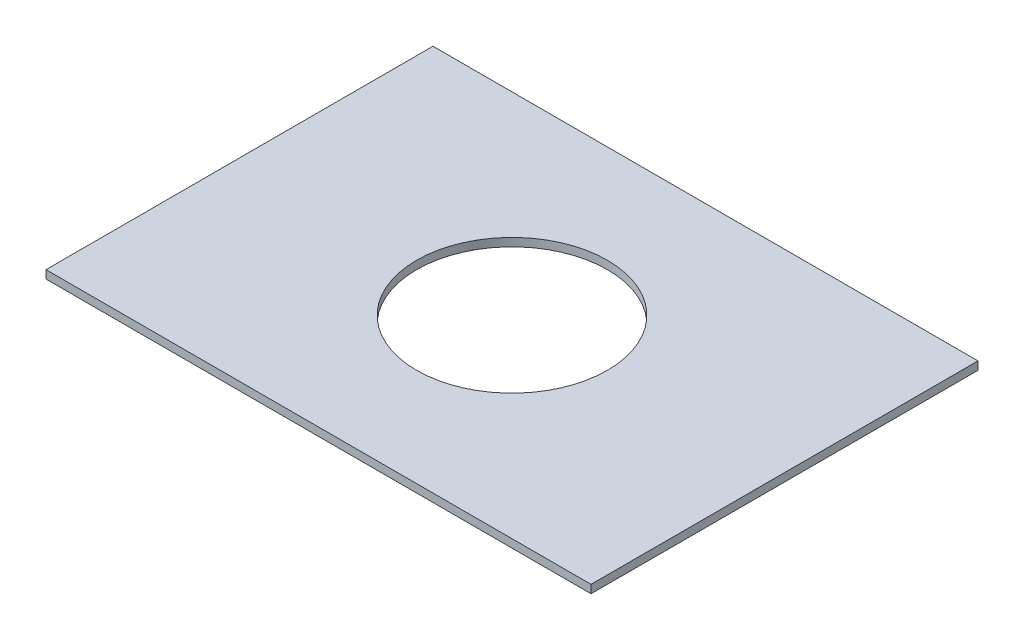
SolidWorks part; units mm, degrees
ref_plane "Plan de face" through (0, 0, 0) normal (0, 0, 1) x (1, 0, 0)
ref_plane "Plan de dessus" through (0, 0, 0) normal (0, 1, 0) x (1, 0, 0)
ref_plane "Plan de droite" through (0, 0, 0) normal (1, 0, 0) x (0, 0, -1)
sketch "Esquisse1" plane through (0, 0, 0) normal (0, 1, 0) x (1, 0, 0)
  line L1 (0, 0) -> (103, 0)
  line L2 (0, 0) -> (0, 75)
  line L3 (0, 75) -> (103, 75)
  line L4 (103, 0) -> (103, 75)
  dimension "D1" = 103
  dimension "D2" = 75
extrude "Boss.-Extru.1" add sketch "Esquisse1" along normal blind 1.5 contours L3 L4 L1 L2
sketch "Esquisse3" plane through (0, 1.5, 0) normal (0, 1, 0) x (1, 0, 0)
  line L0 (101.5, 1.5) -> (101.5, 73.5)
  line L1 (101.5, 73.5) -> (1.5, 73.5)
  line L2 (1.5, 73.5) -> (1.5, 1.5)
  line L3 (1.5, 1.5) -> (101.5, 1.5)
  line L4 (103, 0) -> (103, 75) construction
  line L5 (0, 0) -> (103, 0) construction
  line L6 (0, 0) -> (0, 75) construction
  line L7 (0, 75) -> (103, 75) construction
  line L8 (103, 0) -> (103, 75)
  line L9 (103, 75) -> (0, 75)
  line L10 (0, 75) -> (0, 0)
  line L11 (0, 0) -> (103, 0)
  dimension "D1" = 1.5
  dimension "D2" = 1.5
  dimension "D3" = 1.5
  dimension "D4" = 1.5
extrude "Enlèv. mat.-Extru.1" cut sketch "Esquisse3" against normal blind 10
sketch "Esquisse5" plane through (0, 1.5, 0) normal (0, 1, 0) x (1, 0, 0)
  line L0 (11.5, 1.5) -> (11.5, 10) construction
  line L1 (1.5, 1.5) -> (101.5, 1.5) construction
  line L2 (11.5, 10) -> (21.5, 10) construction
  line L3 (21.5, 10) -> (21.5, 1.5) construction
  line L4 (21.5, 1.5) -> (11.5, 1.5) construction
  line L5 (91.5, 1.5) -> (91.5, 10) construction
  line L6 (91.5, 10) -> (81.5, 10) construction
  line L7 (81.5, 10) -> (81.5, 1.5) construction
  line L8 (81.5, 1.5) -> (91.5, 1.5) construction
  point P6 (16.5, 1.5)
  point P7 (51.5, 1.5)
  point P12 (86.5, 1.5)
  dimension "D1" = 10
  dimension "D2" = 8.5
  dimension "D3" = 35
  dimension "D4" = 10
  dimension "D5" = 8.5
  dimension "D6" = 35
sketch "Esquisse6" plane through (0, 1.5, 0) normal (0, 1, 0) x (1, 0, 0)
  line L0 (101.5, 1.5) -> (101.5, 73.5) construction
  line L1 (101.5, 72.5) -> (1.5, 72.5)
  line L2 (101.5, 72.5) -> (101.5, 73.5)
  line L3 (101.5, 73.5) -> (1.5, 73.5)
  line L4 (1.5, 72.5) -> (1.5, 73.5)
  line L5 (1.5, 73.5) -> (1.5, 1.5) construction
  line L6 (101.5, 73.5) -> (1.5, 73.5) construction
  dimension "D1" = 1
extrude "Enlèv. mat.-Extru.3" cut sketch "Esquisse6" against normal blind 10
sketch "Esquisse7" plane through (0, 1.5, 0) normal (0, 1, 0) x (1, 0, 0)
  line L0 (51.5, 72.5) -> (51.5, 1.5) construction
  line L1 (1.5, 72.5) -> (101.5, 72.5) construction
  line L2 (1.5, 1.5) -> (101.5, 1.5) construction
  line L3 (101.5, 35.5978) -> (1.5, 37) construction
  line L4 (101.5, 1.5) -> (101.5, 72.5) construction
  line L5 (1.5, 72.5) -> (1.5, 1.5) construction
  circle A0 centre (51.5, 37) radius 17.5
  dimension "D1" = 35
extrude "Enlèv. mat.-Extru.4" cut sketch "Esquisse7" against normal blind 10
